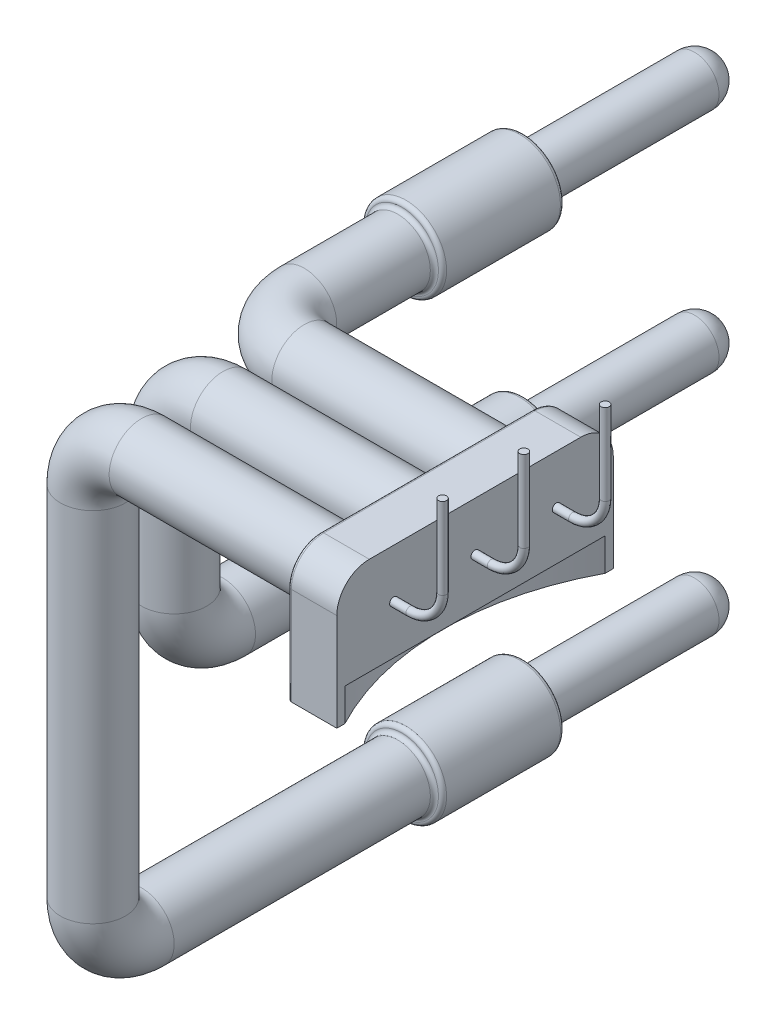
SolidWorks part; units mm, degrees
ref_plane "Plan1" through (0, 0, 0) normal (0, 0, 1) x (1, 0, 0)
ref_plane "Plan2" through (0, 0, 0) normal (0, 1, 0) x (1, 0, 0)
ref_plane "Plan3" through (0, 0, 0) normal (1, 0, 0) x (0, 0, -1)
sketch "Esquisse1" plane through (0, 0, 0) normal (0, 0, 1) x (1, 0, 0)
  circle A0 centre (0, 0) radius 1.5
  dimension "D1" = 3
extrude "Extrusion1" add sketch "Esquisse1" along normal blind 12
fillet "Congé1" radius 1.5
sketch "Esquisse2" plane through (0, 0, 12) normal (0, 0, 1) x (1, 0, 0)
  circle A0 centre (0, 0) radius 2.5
  dimension "D1" = 5
extrude "Extrusion2" add sketch "Esquisse2" along normal blind 7.5
sketch "Esquisse3" plane through (0, 0, 19.5) normal (0, 0, 1) x (1, 0, 0)
  circle A0 centre (0, 0) radius 2
  dimension "D1" = 4
extrude "Extrusion3" add sketch "Esquisse3" along normal blind 1
sketch "Esquisse5" plane through (0, 0, 20.5) normal (0, 0, 1) x (1, 0, 0)
  circle A1 centre (0, 0) radius 2
  circle A2 centre (0, 0) radius 2
  dimension "D1" = 0
sketch "Esquisse6" plane through (0, 0, 0) normal (0, 1, 0) x (1, 0, 0)
  line L0 (0, -20.5) -> (0, -25.5)
  line L1 (3, -28.5) -> (15.5, -28.5)
  arc A0 (0, -25.5) -> (3, -28.5) centre (3, -25.5) ccw
  dimension "D1" = 3
  dimension "D2" = 5
  dimension "D3" = 15.5
sweep "Balayage1" add profiles "Esquisse5" path "Esquisse6"
fillet "Congé2" radius 0.25
fillet "Congé3" radius 0.25
sketch "Esquisse7" plane through (15.5, 0, 0) normal (1, 0, 0) x (0, 0, -1)
  line L0 (-38.5, 2.25) -> (-28.5, 2.25)
  line L1 (-28.5, -2.25) -> (-38.5, -2.25)
  arc A0 (-28.5, -2.25) -> (-28.5, 2.25) centre (-28.5, 0) ccw
  arc A1 (-38.5, 2.25) -> (-38.5, -2.25) centre (-38.5, 0) ccw
  circle A2 centre (-28.5, 0) radius 2 construction
  dimension "D2" = 4.5
  dimension "D3" = 4.5
  dimension "D1" = 10
extrude "Extrusion4" add sketch "Esquisse7" along normal blind 1
sketch "Esquisse8" plane through (15.5, 0, 0) normal (-1, 0, 0) x (0, 0, 1)
  circle A0 centre (38.5, 0) radius 2
  dimension "D1" = 4
ref_plane "Plan4" through (0, 0, 38.5) normal (0, 0, 1) x (1, 0, 0)
sketch "Esquisse10" plane through (0, 0, 38.5) normal (0, 0, 1) x (1, 0, 0)
  line L0 (15.5, 0) -> (3, 0)
  line L1 (0, -3) -> (0, -4)
  arc A0 (0, -3) -> (3, 0) centre (3, -3) cw
  point P7 (0, 0)
  dimension "D1" = 3
  dimension "D2" = 4
sweep "Balayage2" add profiles "Esquisse8" path "Esquisse10"
sketch "Esquisse12" plane through (15.5, 0, 0) normal (-1, 0, 0) x (0, 0, 1)
  circle A0 centre (33.5, 0) radius 2
  circle A1 centre (28.5, 0) radius 2 construction
  dimension "D1" = 4
  dimension "D2" = 5
ref_plane "Plan5" through (0, 0, 33.5) normal (0, 0, 1) x (1, 0, 0)
sketch "Esquisse13" plane through (0, 0, 33.5) normal (0, 0, 1) x (1, 0, 0)
  line L0 (15.5, 0) -> (3, 0)
  line L1 (0, -3) -> (0, -4)
  arc A0 (0, -3) -> (3, 0) centre (3, -3) cw
  point P7 (0, 0)
  dimension "D1" = 3
  dimension "D2" = 4
sweep "Balayage3" add profiles "Esquisse12" path "Esquisse13"
sketch "Esquisse14" plane through (0, -4, 0) normal (0, -1, 0) x (1, 0, 0)
  circle A1 centre (0, 33.5) radius 2
  circle A2 centre (0, 33.5) radius 2
  dimension "D1" = 0
sketch "Esquisse15" plane through (0, 0, 0) normal (1, 0, 0) x (0, 0, -1)
  line L0 (-33.5, -4) -> (-33.5, -11)
  line L1 (-30.5, -14) -> (-19.5, -14)
  line L3 (-19.5, 2.25) -> (-19.5, -2.25) construction
  arc A0 (-33.5, -11) -> (-30.5, -14) centre (-30.5, -11) ccw
  dimension "D1" = 3
  dimension "D2" = 14
sweep "Balayage4" add profiles "Esquisse14" path "Esquisse15"
sketch "Esquisse16" plane through (0, -4, 0) normal (0, -1, 0) x (1, 0, 0)
  circle A1 centre (0, 38.5) radius 2
  circle A2 centre (0, 38.5) radius 2
  dimension "D1" = 0
sketch "Esquisse17" plane through (0, 0, 0) normal (1, 0, 0) x (0, 0, -1)
  line L0 (-38.5, -4) -> (-38.5, -25)
  line L1 (-35.5, -28) -> (-19.5, -28)
  line L2 (-19.5, -16) -> (-19.5, -12) construction
  arc A0 (-38.5, -25) -> (-35.5, -28) centre (-35.5, -25) ccw
  dimension "D1" = 3
  dimension "D2" = 28
sweep "Balayage5" add profiles "Esquisse16" path "Esquisse17"
sketch "Esquisse18" plane through (0, 0, 19.5) normal (0, 0, -1) x (-1, 0, 0)
  circle A2 centre (0, -14) radius 2.5
  circle A3 centre (0, -14) radius 2.5
  dimension "D1" = 0.5
extrude "Extrusion5" add sketch "Esquisse18" along normal blind 7.5
sketch "Esquisse19" plane through (0, 0, 12) normal (0, 0, -1) x (-1, 0, 0)
  circle A0 centre (0, -14) radius 1.5
  dimension "D1" = 3
extrude "Extrusion6" add sketch "Esquisse19" along normal blind 12
fillet "Congé4" radius 1.5
fillet "Congé6" radius 0.25
sketch "Esquisse20" plane through (0, 0, 19.5) normal (0, 0, -1) x (-1, 0, 0)
  circle A2 centre (0, -28) radius 2.5
  circle A3 centre (0, -28) radius 2.5
  dimension "D1" = 0.5
extrude "Extrusion7" add sketch "Esquisse20" along normal blind 7.5
sketch "Esquisse21" plane through (0, 0, 12) normal (0, 0, -1) x (-1, 0, 0)
  circle A0 centre (0, -28) radius 1.5
  dimension "D1" = 3
extrude "Extrusion8" add sketch "Esquisse21" along normal blind 12
fillet "Congé7" radius 0.25
fillet "Congé8" radius 1.5
sketch "Esquisse22" plane through (15.5, 0, 0) normal (-1, 0, 0) x (0, 0, 1)
  line L0 (33.5, 7.303) -> (33.5, -19.5802) construction
  line L1 (27, 3) -> (40, 3)
  line L2 (42, 1) -> (42, -3)
  line L3 (42, -3) -> (25, -3)
  line L4 (25, -3) -> (25, 1)
  arc A0 (25, 1) -> (27, 3) centre (27, 1) cw
  arc A1 (42, 1) -> (40, 3) centre (40, 1) ccw
  point P9 (25, 3)
  point P12 (42, 3)
  dimension "D3" = 2
  dimension "D1" = 8.5
  dimension "D2" = 17
  dimension "D4" = 3
  dimension "D5" = 3
extrude "Extrusion9" add sketch "Esquisse22" against normal blind 3
sketch "Esquisse23" plane through (0, -3, 0) normal (0, -1, 0) x (1, 0, 0)
  line L0 (3, 33.5) -> (15.5, 33.5) construction
  line L2 (18.5, 41.5) -> (18.5, 42)
  line L6 (15.5, 42) -> (15.5, 25)
  line L7 (15.5, 25) -> (18.5, 25)
  line L8 (18.5, 25) -> (18.5, 42)
  line L9 (18.5, 42) -> (15.5, 42)
  line L10 (15.5, 42) -> (15.5, 25)
  line L11 (15.5, 25) -> (18.5, 25)
  line L12 (18.5, 25) -> (18.5, 25.5)
  line L13 (18.5, 42) -> (15.5, 42)
  arc A0 (18.5, 41.5) -> (18.5, 25.5) centre (33.5, 33.5) ccw
  dimension "D2" = 34
  dimension "D1" = 18
  dimension "D3" = 0
extrude "Extrusion10" add sketch "Esquisse23" along normal blind 2
fillet "Congé9" radius 0.2
sketch "Esquisse26" plane through (18.5, 0, 0) normal (1, 0, 0) x (0, 0, -1)
  circle A0 centre (-38.5, 0) radius 0.25
  dimension "D1" = 0.5
ref_plane "Plan7" through (0, 0, 38.5) normal (0, 0, 1) x (1, 0, 0)
sketch "Esquisse27" plane through (0, 0, 38.5) normal (0, 0, 1) x (1, 0, 0)
  line L0 (18.5, 0) -> (19.5, 0)
  line L1 (21.5, 2) -> (21.5, 7)
  line L2 (15.5, -4.8) -> (15.5, 1) construction
  arc A0 (21.5, 2) -> (19.5, 0) centre (19.5, 2) cw
  dimension "D1" = 2
  dimension "D2" = 5
  dimension "D3" = 6
sweep "Balayage7" add profiles "Esquisse26" path "Esquisse27"
pattern_linear "Répétition linéaire1" count 3 spacing 5
